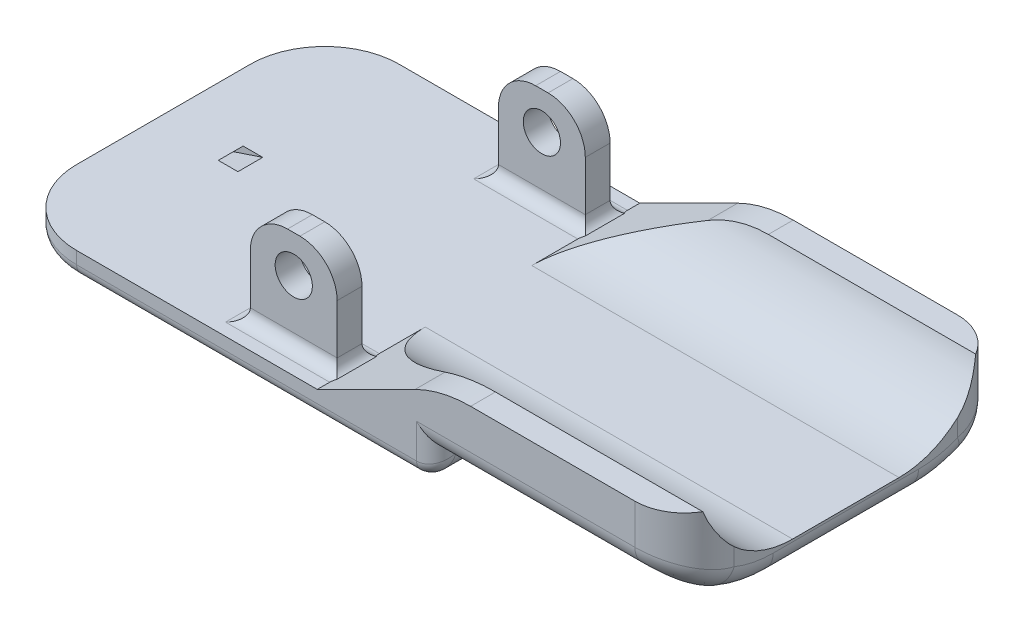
SolidWorks part; units mm, degrees
ref_plane "Front Plane" through (0, 0, 0) normal (0, 0, 1) x (1, 0, 0)
ref_plane "Top Plane" through (0, 0, 0) normal (0, 1, 0) x (1, 0, 0)
ref_plane "Right Plane" through (0, 0, 0) normal (1, 0, 0) x (0, 0, -1)
sketch "Sketch1" plane through (0, 0, 0) normal (0, 1, 0) x (1, 0, 0)
  line L1 (-27.5, 13) -> (27.5, 13)
  line L2 (-27.5, 13) -> (-27.5, -13)
  line L3 (-27.5, -13) -> (27.5, -13)
  line L4 (27.5, 13) -> (27.5, -13)
  line L5 (-27.5, 13) -> (27.5, -13) construction
  line L6 (-27.5, -13) -> (27.5, 13) construction
  point P0 (0, 0)
  dimension "D1" = 55
  dimension "D2" = 26
extrude "Boss-Extrude1" add sketch "Sketch1" along normal blind 2
sketch "Sketch2" plane through (0, 2, 0) normal (0, 1, 0) x (1, 0, 0)
  line L0 (27.5, -13) -> (27.5, 13) construction
  line L1 (-9.5, -11) -> (-2.5, -11)
  line L2 (-9.5, -11) -> (-9.5, -9)
  line L3 (-9.5, -9) -> (-2.5, -9)
  line L4 (-2.5, -11) -> (-2.5, -9)
  line L5 (-9.5, 11) -> (-2.5, 11)
  line L6 (-9.5, 11) -> (-9.5, 9)
  line L7 (-9.5, 9) -> (-2.5, 9)
  line L8 (-2.5, 11) -> (-2.5, 9)
  line L9 (-27.5, -13) -> (27.5, -13) construction
  line L10 (27.5, 13) -> (-27.5, 13) construction
  dimension "D1" = 2
  dimension "D2" = 2
  dimension "D3" = 7
  dimension "D4" = 7
  dimension "D5" = 30
  dimension "D6" = 30
  dimension "D7" = 2
  dimension "D8" = 2
extrude "Boss-Extrude2" add sketch "Sketch2" along normal blind 8
sketch "Sketch3" plane through (0, 0, 11) normal (0, 0, 1) x (1, 0, 0)
  line L0 (-9.5, 10) -> (-2.5, 10) construction
  line L1 (-2.5, 10) -> (-2.5, 2) construction
  circle A0 centre (-6, 7) radius 1.5
  dimension "D1" = 3
  dimension "D2" = 3
  dimension "D3" = 3.5
extrude "Cut-Extrude1" cut sketch "Sketch3" against normal through all
fillet "Fillet1" radius 3 4 edges at (-2.5, 10, 10) (-9.5, 10, 10) (-9.5, 10, -10) (-2.5, 10, -10)
sketch "Sketch5" plane through (0, 2, 0) normal (0, 1, 0) x (1, 0, 0)
  line L1 (27.5, 13) -> (-2.1042, 13)
  line L2 (27.5, 13) -> (27.5, 11)
  line L3 (27.5, 11) -> (-2.1042, 11)
  line L4 (-2.1042, 13) -> (-2.1042, 11)
  line L5 (27.5, -13) -> (-2.1042, -13)
  line L6 (27.5, -13) -> (27.5, -11)
  line L7 (27.5, -11) -> (-2.1042, -11)
  line L8 (-2.1042, -13) -> (-2.1042, -11)
  dimension "D1" = 2
  dimension "D2" = 2
  dimension "D3" = 29.6042
extrude "Boss-Extrude5" add sketch "Sketch5" along normal blind 5
sketch "Sketch6" plane through (0, 0, 13) normal (0, 0, 1) x (1, 0, 0)
  line L0 (-2.1042, 2) -> (7.8958, 7)
  line L1 (-2.1042, 7) -> (27.5, 7) construction
  line L2 (7.8958, 7) -> (-2.1042, 7)
  line L3 (-2.1042, 7) -> (-2.1042, 2)
  dimension "D1" = 10
extrude "Cut-Extrude2" cut sketch "Sketch6" against normal through all
fillet "Fillet2" radius 7 2 edges at (12.6979, 2, 11) (12.6979, 2, -11)
sketch "Sketch8" plane through (27.5, 0, 0) normal (1, 0, 0) x (0, 0, -1)
  line L0 (-13, 0) -> (-10, 0)
  line L1 (-13, 0) -> (13, 0) construction
  line L2 (-10, 0) -> (-13, 3)
  line L3 (-13, 7) -> (-13, 0) construction
  line L4 (-13, 3) -> (-13, 0)
  line L5 (0, 0) -> (0, 5.8143) construction
  line L6 (13, 0) -> (10, 0)
  line L7 (13, 3) -> (13, 0)
  line L8 (10, 0) -> (13, 3)
  dimension "D1" = 3
  dimension "D2" = 3
extrude "Cut-Extrude3" cut sketch "Sketch8" against normal blind 20
fillet "Fillet4" radius 4 2 edges at (27.5, 5, -13) (27.5, 5, 13)
fillet "Fillet5" radius 6 2 edges at (-27.5, 1, -13) (-27.5, 1, 13)
fillet "Fillet6" radius 1 5 edges at (-7, 0, 13) (-25.7426, 0, 11.2426) (-27.5, 0, 0) (-25.7426, 0, -11.2426) (-7, 0, -13)
fillet "Fillet7" radius 1 8 edges at (-9.5, 2, -10) (-6, 2, -9) (-6, 2, -11) (-2.5, 2, -10) (-6, 2, 9) (-2.5, 2, 10) (-9.5, 2, 10) (-6, 2, 11)
fillet "Fillet8" radius 10 2 edges at (17.4365, 0, -10) (17.4365, 0, 10)
fillet "Fillet9" radius 1.8 7 edges at (15.5, 3, -13) (26.6016, 1.7615, -11.5259) (27.5, 0.1274, -7.4492) (27.5, 0.1274, 7.4492) (27.5, 0, 0) (26.5209, 1.8283, 11.6219) (15.5, 3, 13)
fillet "Fillet10" radius 1.6 6 edges at (7.5, 2.3895, -13) (7.5, 0, -8.9289) (7.5, 0.2929, 12.7071) (7.5, 2.3895, 13) (7.5, 0.2929, -12.7071) (7.5, 0, 8.9289)
fillet "Fillet11" radius 10 2 edges at (7.8958, 7, -12) (7.8958, 7, 12)
sketch "Sketch9" plane through (0, 0, 0) normal (0, 0, 1) x (1, 0, 0)
  line L0 (-22.0811, 2) -> (-23.0298, 1.6838)
  line L1 (-21.5, 2) -> (-2.1042, 2) construction
  line L2 (-23.0298, 1.6838) -> (-22.8717, 1.2094)
  line L3 (-22.8717, 1.2094) -> (-20.5, 2)
  line L4 (-20.5, 2) -> (-22.0811, 2)
  dimension "D1" = 0.5
  dimension "D2" = 1
  dimension "D3" = 10
  dimension "D4" = 2.5
extrude "Cut-Extrude4" cut sketch "Sketch9" against normal mid plane 2
